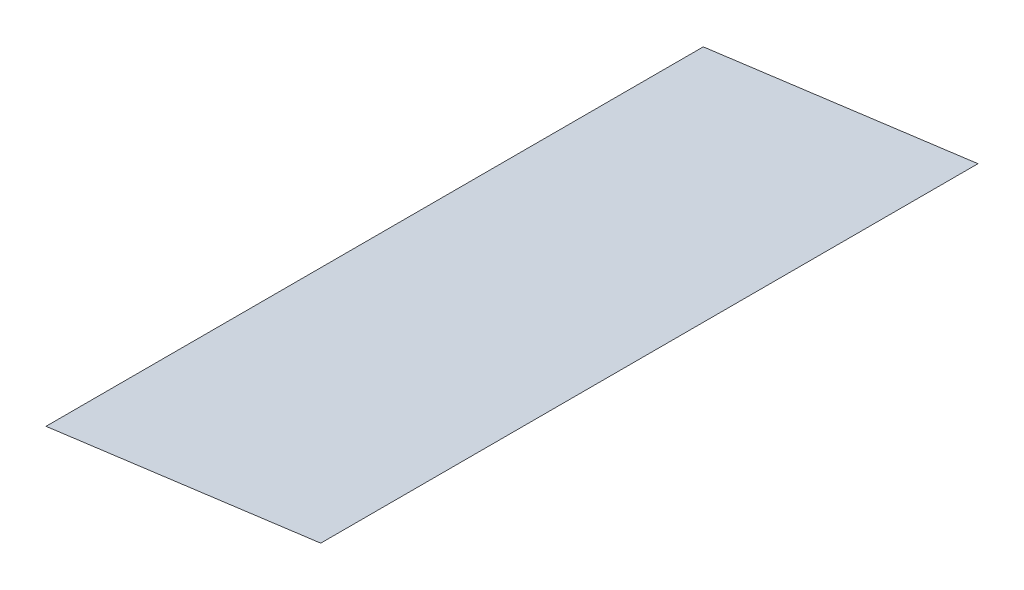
SolidWorks part; units mm, degrees
ref_plane "Ebene vorne" through (0, 0, 0) normal (0, 0, 1) x (1, 0, 0)
ref_plane "Ebene oben" through (0, 0, 0) normal (0, 1, 0) x (1, 0, 0)
ref_plane "Ebene rechts" through (0, 0, 0) normal (1, 0, 0) x (0, 0, -1)
sketch "Skizze2" plane through (0, 0, 0) normal (0, 0, 1) x (1, 0, 0)
  line L0 (-2.1806, 99.8134) -> (-17.1087, 97.848) construction
  line L1 (-0.0257, 100.0971) -> (-1.5128, 99.9013) construction
  line L2 (-1.5511, 100.0937) -> (-27.3568, 196.4018) construction
  line L3 (-1.5, 0) -> (-1.5, 99.7055) construction
  line L4 (-5.8488, 99.3304) -> (22.8468, 103.1083)
surface "Oberfläche-Linear austragen1" sketch "Skizze2" parameters "D1"=68.6496
equation "\"LÄNGE\"=0"
equation "\"BREITE\"=0"
equation "\"HÖHE\"=0"
equation "\"DURCHMESSER\"=0"
equation "\"Stückzahl\"= 1"
